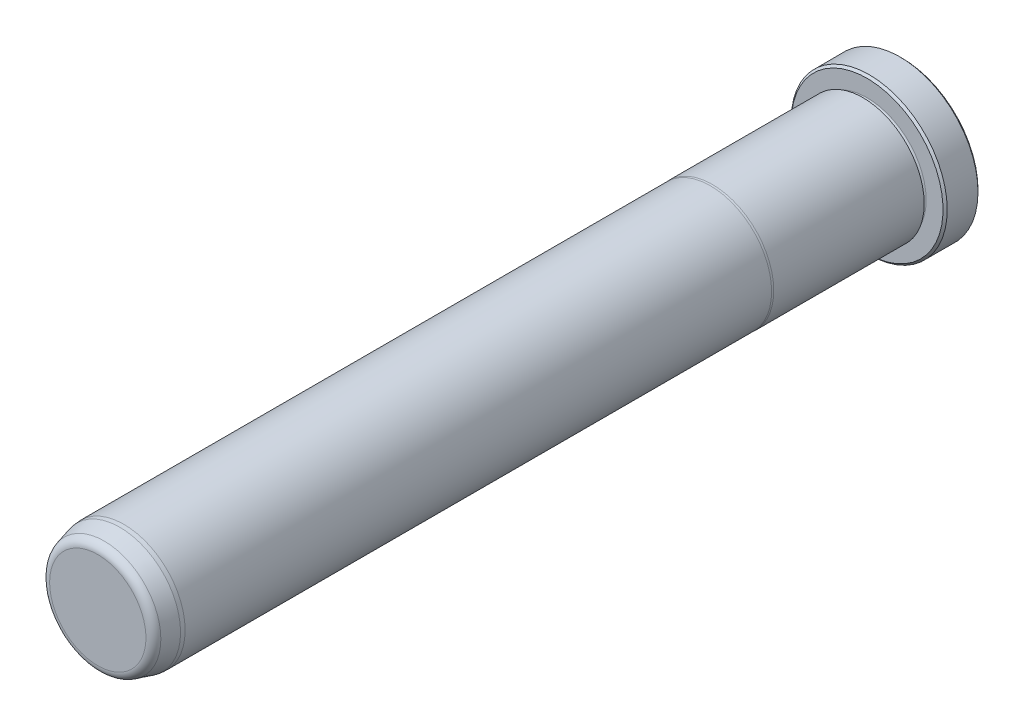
SolidWorks part; units mm, degrees
ref_plane "Front Plane" through (0, 0, 0) normal (0, 0, 1) x (1, 0, 0)
ref_plane "Top Plane" through (0, 0, 0) normal (0, 1, 0) x (1, 0, 0)
ref_plane "Right Plane" through (0, 0, 0) normal (1, 0, 0) x (0, 0, -1)
sketch "Sketch1" plane through (0, 0, 0) normal (1, 0, 0) x (0, 0, -1)
  line L0 (0, 0) -> (0, 14.1605)
  line L1 (0, 14.1605) -> (-6.35, 14.1605)
  line L2 (-6.35, 14.1605) -> (-6.35, 10.7188)
  line L3 (-6.35, 10.3378) -> (-7.112, 10.3378) construction
  line L4 (-7.112, 10.7188) -> (-7.112, 11.1252)
  line L5 (-7.112, 11.1252) -> (-34.4348, 11.1252)
  line L6 (-34.4348, 11.1252) -> (-34.798, 11.0998)
  line L7 (-34.798, 11.0998) -> (-141.2875, 11.0998)
  line L9 (-146.05, 9.9612) -> (-146.05, 0)
  line L10 (-146.05, 0) -> (0, 0)
  line L11 (0, 0) -> (13.6287, 0) construction
  line L12 (-141.2875, 11.0998) -> (-142.0495, 11.0331)
  line L13 (-142.0495, 11.0331) -> (-146.05, 9.9612)
  arc A0 (-7.112, 10.7188) -> (-6.35, 10.7188) centre (-6.731, 10.7188) ccw
  dimension "D14" = 0.762
  dimension "D1" = 6.35
  dimension "D2" = 0.762
  dimension "D3" = 28.321
  dimension "D4" = 22.2504
  dimension "D5" = 34.798
  dimension "D6" = 146.05
  dimension "D7" = 0.7874
  dimension "D8" = 4
  dimension "D9" = 22.1996
  dimension "D10" = 5
  dimension "D11" = 15
  dimension "D12" = 0.762
  dimension "D13" = 4.7625
revolve "Revolve1" add sketch "Sketch1" angle 360 about L11
fillet "Fillet6" radius 1.5875 1 edges at (9.9612, 0, 146.05)
chamfer "Chamfer1" distance 0.381 angle 45 2 edges at (14.1605, 0, 0) (14.1605, 0, 6.35)
